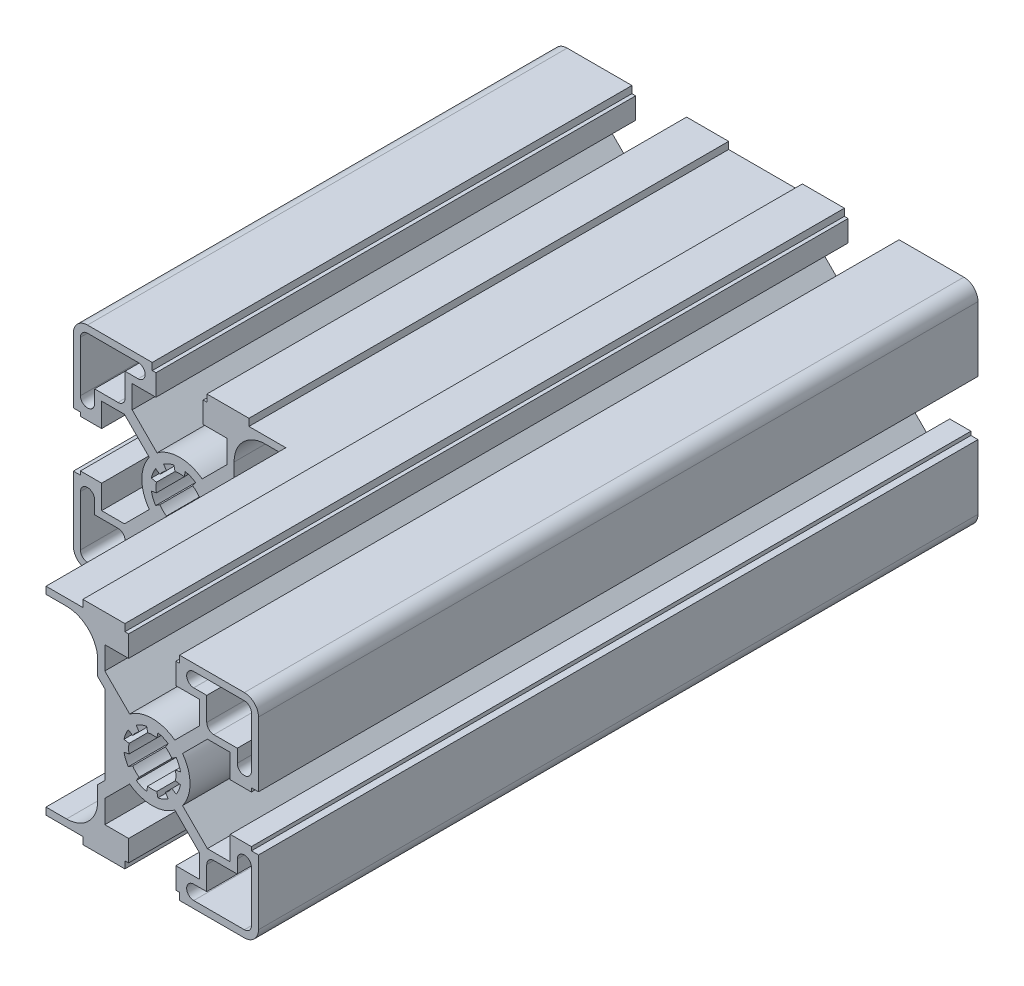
SolidWorks part; units mm, degrees
ref_plane "Front Plane" through (0, 0, 0) normal (0, 0, 1) x (1, 0, 0)
ref_plane "Top Plane" through (0, 0, 0) normal (0, 1, 0) x (1, 0, 0)
ref_plane "Right Plane" through (0, 0, 0) normal (1, 0, 0) x (0, 0, -1)
sketch "Sketch1" plane through (0, 0, 0) normal (0, 0, 1) x (1, 0, 0)
  line L0 (-27.5082, 0) -> (-17.5006, 0) construction
  line L1 (17.5006, 0) -> (27.5082, 0) construction
  line L2 (-42.0116, 22.5044) -> (-28.2956, 22.5044)
  line L3 (-28.2956, 22.5044) -> (-28.2956, 21.0058)
  line L4 (-28.2956, 21.0058) -> (-27.5082, 21.0058)
  line L5 (22.5044, -5.0038) -> (22.5044, 5.0038) construction
  line L6 (-27.5082, 21.0058) -> (-27.5082, 16.51)
  line L7 (-27.5082, 16.51) -> (-32.5501, 16.51)
  line L8 (-32.5501, 16.51) -> (-32.5501, 11.6801)
  line L9 (-32.5501, 11.6801) -> (-27.2854, 6.4154)
  line L11 (-34.1845, 10.0457) -> (-28.9198, 4.781)
  line L12 (-39.0144, 10.0457) -> (-34.1845, 10.0457)
  line L13 (-39.0144, 5.0038) -> (-39.0144, 10.0457)
  line L14 (-43.5102, 5.0038) -> (-39.0144, 5.0038)
  line L15 (-43.5102, 5.7912) -> (-43.5102, 5.0038)
  line L16 (-45.0088, 5.7912) -> (-43.5102, 5.7912)
  line L17 (-45.0088, 19.5072) -> (-45.0088, 5.7912)
  line L18 (-40.513, 11.5443) -> (-35.5473, 11.5443)
  line L19 (-40.513, 11.5443) -> (-40.513, 8.7884)
  line L20 (-34.0487, 18.0086) -> (-34.0487, 13.0429)
  line L21 (-43.5102, 19.5072) -> (-43.5102, 8.7884)
  line L23 (-34.0487, 18.0086) -> (-31.2928, 18.0086)
  line L24 (-42.0116, 21.0058) -> (-31.2928, 21.0058)
  line L25 (-21.3151, 5.9789) -> (-21.5282, 4.9077)
  line L26 (-23.6937, 5.9789) -> (-23.4806, 4.9077)
  line L27 (-17.4358, 3.3868) -> (-18.3439, 2.78)
  line L28 (-19.1176, 5.0686) -> (-19.7244, 4.1605)
  line L29 (-16.5255, -1.1893) -> (-17.5967, -0.9762)
  line L30 (-16.5255, 1.1893) -> (-17.5967, 0.9762)
  line L31 (-19.1176, -5.0686) -> (-19.7244, -4.1605)
  line L32 (-17.4358, -3.3868) -> (-18.3439, -2.78)
  line L33 (-23.6937, -5.9789) -> (-23.4806, -4.9077)
  line L34 (-21.3151, -5.9789) -> (-21.5282, -4.9077)
  line L35 (-27.573, -3.3868) -> (-26.6649, -2.78)
  line L36 (-25.8912, -5.0686) -> (-25.2844, -4.1605)
  line L37 (-28.4833, 1.1893) -> (-27.4121, 0.9762)
  line L38 (-28.4833, -1.1893) -> (-27.4121, -0.9762)
  line L39 (-25.8912, 5.0686) -> (-25.2844, 4.1605)
  line L40 (-27.573, 3.3868) -> (-26.6649, 2.78)
  line L41 (-7.8105, 22.5044) -> (-7.8105, 21.0058)
  line L42 (-7.8105, 21.0058) -> (7.8105, 21.0058)
  line L43 (-7.8105, 22.5044) -> (-16.7132, 22.5044)
  line L44 (-16.7132, 22.5044) -> (-16.7132, 21.0058)
  line L45 (-16.7132, 21.0058) -> (-17.5006, 21.0058)
  line L46 (-17.5006, 21.0058) -> (-17.5006, 16.51)
  line L47 (-17.5006, 16.51) -> (-12.4587, 16.51)
  line L48 (-12.4587, 16.51) -> (-12.4587, 11.6801)
  line L49 (-12.4587, 11.6801) -> (-17.7234, 6.4154)
  line L50 (-10.9601, 9.9099) -> (-12.4587, 8.4113)
  line L51 (7.8105, 21.0058) -> (7.8105, 22.5044)
  line L53 (-7.8105, -22.5044) -> (-16.7132, -22.5044)
  line L54 (7.8105, -22.5044) -> (16.7132, -22.5044)
  line L55 (7.8105, -21.0058) -> (7.8105, -22.5044)
  line L56 (-7.8105, -21.0058) -> (7.8105, -21.0058)
  line L57 (-7.8105, -22.5044) -> (-7.8105, -21.0058)
  line L58 (-40.513, -11.5443) -> (-35.5473, -11.5443)
  line L59 (4.3561, 19.5072) -> (-4.3561, 19.5072)
  line L60 (-10.9601, 12.9032) -> (-10.9601, 9.9099)
  line L61 (-12.4587, -8.4113) -> (-10.9601, -9.9099)
  line L62 (-12.4587, 8.4113) -> (-12.4587, -8.4113)
  line L63 (-10.9601, -12.9032) -> (-10.9601, -9.9099)
  line L64 (4.3561, -19.5072) -> (-4.3561, -19.5072)
  line L65 (10.9601, 12.9032) -> (10.9601, 9.9099)
  line L66 (10.9601, -12.9032) -> (10.9601, -9.9099)
  line L67 (12.4587, 8.4113) -> (12.4587, -8.4113)
  line L68 (10.9601, -9.9099) -> (12.4587, -8.4113)
  line L69 (10.9601, 9.9099) -> (12.4587, 8.4113)
  line L70 (-12.4587, -11.6801) -> (-17.7234, -6.4154)
  line L71 (-12.4587, -16.51) -> (-12.4587, -11.6801)
  line L72 (-17.5006, -16.51) -> (-12.4587, -16.51)
  line L73 (-17.5006, -21.0058) -> (-17.5006, -16.51)
  line L74 (-16.7132, -21.0058) -> (-17.5006, -21.0058)
  line L75 (-16.7132, -22.5044) -> (-16.7132, -21.0058)
  line L76 (-34.0487, -18.0086) -> (-31.2928, -18.0086)
  line L77 (-42.0116, -21.0058) -> (-31.2928, -21.0058)
  line L78 (-42.0116, -22.5044) -> (-28.2956, -22.5044)
  line L79 (-28.2956, -22.5044) -> (-28.2956, -21.0058)
  line L80 (-28.2956, -21.0058) -> (-27.5082, -21.0058)
  line L81 (-27.5082, -21.0058) -> (-27.5082, -16.51)
  line L82 (-27.5082, -16.51) -> (-32.5501, -16.51)
  line L83 (-32.5501, -16.51) -> (-32.5501, -11.6801)
  line L84 (-32.5501, -11.6801) -> (-27.2854, -6.4154)
  line L85 (-34.1845, -10.0457) -> (-28.9198, -4.781)
  line L86 (-43.5102, -19.5072) -> (-43.5102, -8.7884)
  line L87 (-34.0487, -18.0086) -> (-34.0487, -13.0429)
  line L88 (-40.513, -11.5443) -> (-40.513, -8.7884)
  line L89 (-45.0088, -19.5072) -> (-45.0088, -5.7912)
  line L90 (-45.0088, -5.7912) -> (-43.5102, -5.7912)
  line L91 (-43.5102, -5.7912) -> (-43.5102, -5.0038)
  line L92 (-43.5102, -5.0038) -> (-39.0144, -5.0038)
  line L93 (-39.0144, -5.0038) -> (-39.0144, -10.0457)
  line L94 (-39.0144, -10.0457) -> (-34.1845, -10.0457)
  line L96 (42.0116, 21.0058) -> (31.2928, 21.0058)
  line L97 (42.0116, 22.5044) -> (28.2956, 22.5044)
  line L98 (34.0487, 18.0086) -> (31.2928, 18.0086)
  line L99 (27.5082, 21.0058) -> (27.5082, 16.51)
  line L100 (28.2956, 21.0058) -> (27.5082, 21.0058)
  line L101 (28.2956, 22.5044) -> (28.2956, 21.0058)
  line L102 (17.5006, 21.0058) -> (17.5006, 16.51)
  line L103 (16.7132, 21.0058) -> (17.5006, 21.0058)
  line L104 (16.7132, 22.5044) -> (16.7132, 21.0058)
  line L105 (7.8105, 22.5044) -> (16.7132, 22.5044)
  line L106 (39.0144, -10.0457) -> (34.1845, -10.0457)
  line L107 (39.0144, -5.0038) -> (39.0144, -10.0457)
  line L108 (43.5102, -5.0038) -> (39.0144, -5.0038)
  line L109 (43.5102, -5.7912) -> (43.5102, -5.0038)
  line L110 (45.0088, -5.7912) -> (43.5102, -5.7912)
  line L111 (45.0088, -19.5072) -> (45.0088, -5.7912)
  line L112 (40.513, -11.5443) -> (35.5473, -11.5443)
  line L113 (40.513, -11.5443) -> (40.513, -8.7884)
  line L114 (34.0487, -18.0086) -> (34.0487, -13.0429)
  line L115 (43.5102, -19.5072) -> (43.5102, -8.7884)
  line L116 (34.1845, -10.0457) -> (28.9198, -4.781)
  line L117 (32.5501, -11.6801) -> (27.2854, -6.4154)
  line L118 (32.5501, -16.51) -> (32.5501, -11.6801)
  line L119 (27.5082, -16.51) -> (32.5501, -16.51)
  line L120 (27.5082, -21.0058) -> (27.5082, -16.51)
  line L121 (28.2956, -21.0058) -> (27.5082, -21.0058)
  line L122 (28.2956, -22.5044) -> (28.2956, -21.0058)
  line L123 (42.0116, -22.5044) -> (28.2956, -22.5044)
  line L124 (42.0116, -21.0058) -> (31.2928, -21.0058)
  line L125 (34.0487, -18.0086) -> (31.2928, -18.0086)
  line L126 (16.7132, -22.5044) -> (16.7132, -21.0058)
  line L127 (16.7132, -21.0058) -> (17.5006, -21.0058)
  line L128 (17.5006, -21.0058) -> (17.5006, -16.51)
  line L129 (17.5006, -16.51) -> (12.4587, -16.51)
  line L130 (12.4587, -16.51) -> (12.4587, -11.6801)
  line L131 (12.4587, -11.6801) -> (17.7234, -6.4154)
  line L132 (12.4587, 11.6801) -> (17.7234, 6.4154)
  line L133 (12.4587, 16.51) -> (12.4587, 11.6801)
  line L134 (27.573, 3.3868) -> (26.6649, 2.78)
  line L135 (25.8912, 5.0686) -> (25.2844, 4.1605)
  line L136 (28.4833, -1.1893) -> (27.4121, -0.9762)
  line L137 (28.4833, 1.1893) -> (27.4121, 0.9762)
  line L138 (25.8912, -5.0686) -> (25.2844, -4.1605)
  line L139 (27.573, -3.3868) -> (26.6649, -2.78)
  line L140 (21.3151, -5.9789) -> (21.5282, -4.9077)
  line L141 (23.6937, -5.9789) -> (23.4806, -4.9077)
  line L142 (17.4358, -3.3868) -> (18.3439, -2.78)
  line L143 (19.1176, -5.0686) -> (19.7244, -4.1605)
  line L144 (16.5255, 1.1893) -> (17.5967, 0.9762)
  line L145 (16.5255, -1.1893) -> (17.5967, -0.9762)
  line L146 (19.1176, 5.0686) -> (19.7244, 4.1605)
  line L147 (17.4358, 3.3868) -> (18.3439, 2.78)
  line L148 (23.6937, 5.9789) -> (23.4806, 4.9077)
  line L149 (21.3151, 5.9789) -> (21.5282, 4.9077)
  line L150 (43.5102, 19.5072) -> (43.5102, 8.7884)
  line L151 (34.0487, 18.0086) -> (34.0487, 13.0429)
  line L152 (40.513, 11.5443) -> (40.513, 8.7884)
  line L153 (40.513, 11.5443) -> (35.5473, 11.5443)
  line L154 (45.0088, 19.5072) -> (45.0088, 5.7912)
  line L155 (45.0088, 5.7912) -> (43.5102, 5.7912)
  line L156 (43.5102, 5.7912) -> (43.5102, 5.0038)
  line L157 (43.5102, 5.0038) -> (39.0144, 5.0038)
  line L158 (39.0144, 5.0038) -> (39.0144, 10.0457)
  line L159 (39.0144, 10.0457) -> (34.1845, 10.0457)
  line L160 (34.1845, 10.0457) -> (28.9198, 4.781)
  line L161 (32.5501, 11.6801) -> (27.2854, 6.4154)
  line L162 (32.5501, 16.51) -> (32.5501, 11.6801)
  line L163 (12.4587, 16.51) -> (17.5006, 16.51)
  line L164 (27.5082, 16.51) -> (32.5501, 16.51)
  arc A0 (-45.0088, 19.5072) -> (-42.0116, 22.5044) centre (-42.0116, 19.5072) cw
  arc A1 (-43.5102, 8.7884) -> (-40.513, 8.7884) centre (-42.0116, 8.7884) ccw
  arc A2 (-43.5102, 19.5072) -> (-42.0116, 21.0058) centre (-42.0116, 19.5072) cw
  arc A3 (-31.2928, 21.0058) -> (-31.2928, 18.0086) centre (-31.2928, 19.5072) cw
  arc A4 (-34.0487, 13.0429) -> (-35.5473, 11.5443) centre (-35.5473, 13.0429) cw
  arc A6 (-21.5282, 4.9077) -> (-23.4806, 4.9077) centre (-22.5044, 0) ccw
  arc A7 (-27.573, 3.3868) -> (-28.4833, 1.1893) centre (-22.5044, 0) ccw
  arc A8 (-18.3439, 2.78) -> (-19.7244, 4.1605) centre (-22.5044, 0) ccw
  arc A9 (-17.5967, -0.9762) -> (-17.5967, 0.9762) centre (-22.5044, 0) ccw
  arc A10 (-19.7244, -4.1605) -> (-18.3439, -2.78) centre (-22.5044, 0) ccw
  arc A11 (-23.4806, -4.9077) -> (-21.5282, -4.9077) centre (-22.5044, 0) ccw
  arc A12 (-26.6649, -2.78) -> (-25.2844, -4.1605) centre (-22.5044, 0) ccw
  arc A13 (-27.4121, 0.9762) -> (-27.4121, -0.9762) centre (-22.5044, 0) ccw
  arc A14 (-25.2844, 4.1605) -> (-26.6649, 2.78) centre (-22.5044, 0) ccw
  arc A15 (-28.4833, -1.1893) -> (-27.573, -3.3868) centre (-22.5044, 0) ccw
  arc A16 (-25.8912, -5.0686) -> (-23.6937, -5.9789) centre (-22.5044, 0) ccw
  arc A17 (-21.3151, -5.9789) -> (-19.1176, -5.0686) centre (-22.5044, 0) ccw
  arc A18 (-17.4358, -3.3868) -> (-16.5255, -1.1893) centre (-22.5044, 0) ccw
  arc A19 (-16.5255, 1.1893) -> (-17.4358, 3.3868) centre (-22.5044, 0) ccw
  arc A20 (-19.1176, 5.0686) -> (-21.3151, 5.9789) centre (-22.5044, 0) ccw
  arc A21 (-23.6937, 5.9789) -> (-25.8912, 5.0686) centre (-22.5044, 0) ccw
  arc A22 (-34.0487, -13.0429) -> (-35.5473, -11.5443) centre (-35.5473, -13.0429) ccw
  arc A23 (-4.3561, 19.5072) -> (-10.9601, 12.9032) centre (-4.3561, 12.9032) ccw
  arc A24 (-4.3561, -19.5072) -> (-10.9601, -12.9032) centre (-4.3561, -12.9032) cw
  arc A25 (4.3561, 19.5072) -> (10.9601, 12.9032) centre (4.3561, 12.9032) cw
  arc A26 (4.3561, -19.5072) -> (10.9601, -12.9032) centre (4.3561, -12.9032) ccw
  arc A27 (-31.2928, -21.0058) -> (-31.2928, -18.0086) centre (-31.2928, -19.5072) ccw
  arc A28 (-43.5102, -19.5072) -> (-42.0116, -21.0058) centre (-42.0116, -19.5072) ccw
  arc A29 (-45.0088, -19.5072) -> (-42.0116, -22.5044) centre (-42.0116, -19.5072) ccw
  arc A30 (-43.5102, -8.7884) -> (-40.513, -8.7884) centre (-42.0116, -8.7884) cw
  arc A31 (-17.7234, 6.4154) -> (-27.2854, 6.4154) centre (-22.5044, 0) ccw
  arc A32 (-27.2854, -6.4154) -> (-17.7234, -6.4154) centre (-22.5044, 0) ccw
  arc A33 (-28.9198, 4.781) -> (-28.9198, -4.781) centre (-22.5044, 0) ccw
  arc A34 (45.0088, 19.5072) -> (42.0116, 22.5044) centre (42.0116, 19.5072) ccw
  arc A35 (43.5102, 19.5072) -> (42.0116, 21.0058) centre (42.0116, 19.5072) ccw
  arc A36 (31.2928, 21.0058) -> (31.2928, 18.0086) centre (31.2928, 19.5072) ccw
  arc A37 (28.9198, 4.781) -> (28.9198, -4.781) centre (22.5044, 0) cw
  arc A38 (27.2854, -6.4154) -> (17.7234, -6.4154) centre (22.5044, 0) cw
  arc A39 (17.7234, 6.4154) -> (27.2854, 6.4154) centre (22.5044, 0) cw
  arc A40 (43.5102, -8.7884) -> (40.513, -8.7884) centre (42.0116, -8.7884) ccw
  arc A41 (34.0487, -13.0429) -> (35.5473, -11.5443) centre (35.5473, -13.0429) cw
  arc A42 (45.0088, -19.5072) -> (42.0116, -22.5044) centre (42.0116, -19.5072) cw
  arc A43 (43.5102, -19.5072) -> (42.0116, -21.0058) centre (42.0116, -19.5072) cw
  arc A44 (31.2928, -21.0058) -> (31.2928, -18.0086) centre (31.2928, -19.5072) cw
  arc A45 (23.6937, 5.9789) -> (25.8912, 5.0686) centre (22.5044, 0) cw
  arc A46 (19.1176, 5.0686) -> (21.3151, 5.9789) centre (22.5044, 0) cw
  arc A47 (16.5255, 1.1893) -> (17.4358, 3.3868) centre (22.5044, 0) cw
  arc A48 (17.4358, -3.3868) -> (16.5255, -1.1893) centre (22.5044, 0) cw
  arc A49 (21.3151, -5.9789) -> (19.1176, -5.0686) centre (22.5044, 0) cw
  arc A50 (25.8912, -5.0686) -> (23.6937, -5.9789) centre (22.5044, 0) cw
  arc A51 (28.4833, -1.1893) -> (27.573, -3.3868) centre (22.5044, 0) cw
  arc A52 (25.2844, 4.1605) -> (26.6649, 2.78) centre (22.5044, 0) cw
  arc A53 (27.4121, 0.9762) -> (27.4121, -0.9762) centre (22.5044, 0) cw
  arc A54 (26.6649, -2.78) -> (25.2844, -4.1605) centre (22.5044, 0) cw
  arc A55 (23.4806, -4.9077) -> (21.5282, -4.9077) centre (22.5044, 0) cw
  arc A56 (19.7244, -4.1605) -> (18.3439, -2.78) centre (22.5044, 0) cw
  arc A57 (17.5967, -0.9762) -> (17.5967, 0.9762) centre (22.5044, 0) cw
  arc A58 (18.3439, 2.78) -> (19.7244, 4.1605) centre (22.5044, 0) cw
  arc A59 (27.573, 3.3868) -> (28.4833, 1.1893) centre (22.5044, 0) cw
  arc A60 (21.5282, 4.9077) -> (23.4806, 4.9077) centre (22.5044, 0) cw
  arc A62 (34.0487, 13.0429) -> (35.5473, 11.5443) centre (35.5473, 13.0429) ccw
  arc A63 (43.5102, 8.7884) -> (40.513, 8.7884) centre (42.0116, 8.7884) cw
extrude "Boss-Extrude1" add sketch "Sketch1" along normal mid plane 152.4
sketch "Sketch2" plane through (0, 0, 76.2) normal (0, 0, 1) x (1, 0, 0)
  line L0 (7.8105, 21.0058) -> (-7.8105, 21.0058) construction
  line L1 (-45.0088, 22.5044) -> (0, 22.5044)
  line L2 (-45.0088, 22.5044) -> (-45.0088, -22.5044)
  line L3 (-45.0088, -22.5044) -> (0, -22.5044)
  line L4 (0, 22.5044) -> (0, -22.5044)
  line L5 (-28.2956, 22.5044) -> (-42.0116, 22.5044) construction
  line L6 (-42.0116, -22.5044) -> (-28.2956, -22.5044) construction
  line L7 (-45.0088, 19.5072) -> (-45.0088, 5.7912) construction
  point P6 (0, 21.0058)
extrude "Cut-Extrude1" cut sketch "Sketch2" against normal offset from surface (50.8 mm away) 101.6
